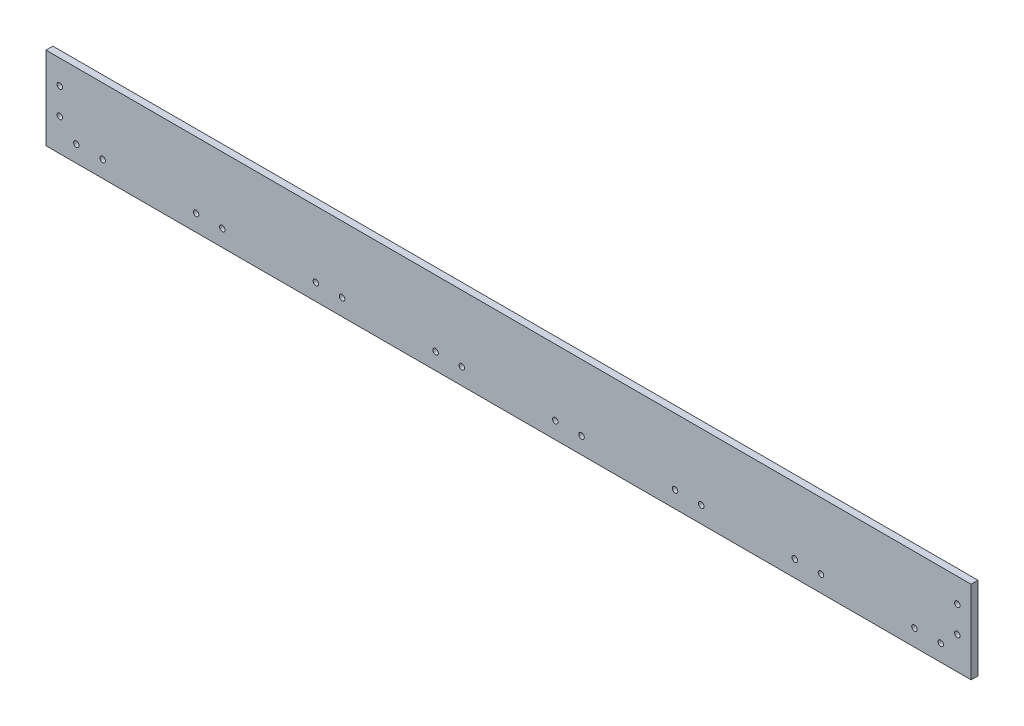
SolidWorks part; units mm, degrees
ref_plane "Front Plane" through (0, 0, 0) normal (0, 0, 1) x (1, 0, 0)
ref_plane "Top Plane" through (0, 0, 0) normal (0, 1, 0) x (1, 0, 0)
ref_plane "Right Plane" through (0, 0, 0) normal (1, 0, 0) x (0, 0, -1)
sketch "Sketch1" plane through (0, 0, 0) normal (0, 0, 1) x (1, 0, 0)
  line L1 (0, 0) -> (850.9, 0)
  line L2 (0, 0) -> (0, 76.2)
  line L3 (0, 76.2) -> (850.9, 76.2)
  line L4 (850.9, 0) -> (850.9, 76.2)
extrude "Boss-Extrude1" add sketch "Sketch1" along normal blind 6.35
sketch "Sketch2" plane through (0, 0, 6.35) normal (0, 0, 1) x (1, 0, 0)
  line L0 (27.94, 0) -> (27.94, 12.7) construction
  line L2 (0, 15.24) -> (25.4, 15.24) construction
  line L3 (0, 76.2) -> (0, 0) construction
  line L4 (0, 0) -> (850.9, 0) construction
  line L5 (30.48, 15.24) -> (49.53, 15.24) construction
  circle A0 centre (27.94, 15.24) radius 2.54
  circle A1 centre (52.07, 15.24) radius 2.54
  point P13 (1219.2, 76.2)
extrude "Cut-Extrude1" cut sketch "Sketch2" against normal up to surface (6.35 mm away) contours A1 | A0
sketch "Sketch3" plane through (0, 0, 6.35) normal (0, 0, 1) x (1, 0, 0)
  line L0 (0, 76.2) -> (0, 0) construction
  line L1 (850.9, 76.2) -> (0, 76.2) construction
  line L2 (12.7, 41.91) -> (0, 41.91) construction
  line L3 (12.7, 51.435) -> (12.7, 32.385) construction
  line L4 (0, 41.91) -> (0, 38.1) construction
  line L5 (425.45, 76.2) -> (425.45, 0) construction
  line L6 (0, 0) -> (850.9, 0) construction
  circle A0 centre (12.7, 29.845) radius 2.54
  circle A1 centre (12.7, 53.975) radius 2.54
  circle A2 centre (838.2, 29.845) radius 2.54
  circle A3 centre (838.2, 53.975) radius 2.54
  point P13 (0, 38.1)
  point P15 (425.45, 76.2)
  point P17 (12.7, 41.91)
  point P27 (12.7, 41.91)
extrude "Cut-Extrude2" cut sketch "Sketch3" against normal up to surface (6.35 mm away)
pattern_linear "LPattern2" count 8 spacing 110.1271 along (1, 0, 0) of "Cut-Extrude1"
equation "\"vertical-component-width\"= \"railing-width\" - \"railing-padding\""
equation "\"vertical-component-height\"= 3in"
equation "\"material-thickness\"= .25in"
equation "\"D1@Sketch1\"=\"vertical-component-height\""
equation "\"D2@Sketch1\"=\"vertical-component-width\""
equation "\"D1@Boss-Extrude1\"=\"material-thickness\""
equation "\"mounting-hole-diameter\"= .2"
equation "\"mounting-hole-pair-left-to-mount-edge-left\"= 1in"
equation "\"mounting-hole-bottom-to-mount-edge-bottom\"= .5in"
equation "\"mounting-hole-pair-distance-between-holes\"= .75in"
equation "\"distance-between-mounting-hole-pairs\"= ( \"vertical-component-width\" - 2 * \"mounting-hole-pair-left-to-mount-edge-left\" - \"num-mounting-hole-pairs\" * ( 2 * \"mounting-hole-diameter\" + \"mounting-hole-pa"
equation "\"num-mounting-hole-pairs\"= 8"
equation "\"D3@Sketch2\"=\"mounting-hole-pair-distance-between-holes\""
equation "\"D5@Sketch2\"=\"mounting-hole-bottom-to-mount-edge-bottom\""
equation "\"D4@Sketch2\"=\"mounting-hole-pair-left-to-mount-edge-left\""
equation "\"D3@LPattern2\"=\"mounting-hole-pair-left-to-next-mounting-hole-pair-left\""
equation "\"D2@Sketch2\"=\"mounting-hole-diameter\""
equation "\"D1@Sketch2\"=\"mounting-hole-diameter\""
equation "\"mounting-hole-pair-left-to-next-mounting-hole-pair-left\"= \"distance-between-mounting-hole-pairs\" + 2 * \"mounting-hole-diameter\" + \"mounting-hole-pair-distance-between-holes\""
equation "\"edge-mounting-hole-pair-inset\"=0.5"
equation "\"D4@Sketch3\"=\"edge-mounting-hole-pair-inset\""
equation "\"edge-mounting-hole-pair-offset-from-mount-vertical-center\"= 0.15"
equation "\"D5@Sketch3\"=\"edge-mounting-hole-pair-offset-from-mount-vertical-center\""
equation "\"D3@Sketch3\"=\"mounting-hole-pair-distance-between-holes\""
equation "\"railing-width\"= 34in"
equation "\"railing-padding\"= .5in"
equation "\"D1@LPattern2\"=\"num-mounting-hole-pairs\""
